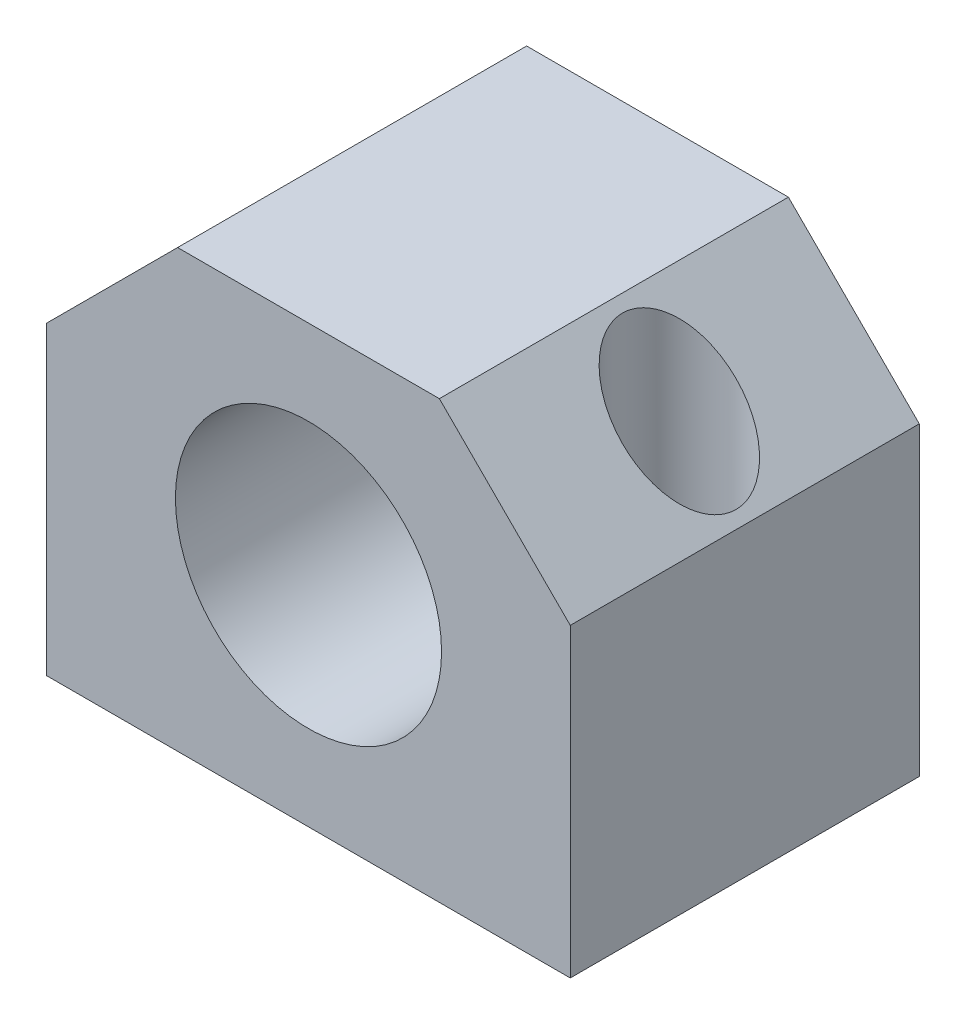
SolidWorks part; units mm, degrees
ref_plane "Plan de face" through (0, 0, 0) normal (0, 0, 1) x (1, 0, 0)
ref_plane "Plan de dessus" through (0, 0, 0) normal (0, 1, 0) x (1, 0, 0)
ref_plane "Plan de droite" through (0, 0, 0) normal (1, 0, 0) x (0, 0, -1)
sketch "Esquisse1" plane through (0, 0, 0) normal (0, 0, 1) x (1, 0, 0)
  line L0 (-35.9199, 0) -> (33.5688, 0) construction
  line L1 (0, 38.7935) -> (0, -32.5238) construction
  line L2 (-30, -25) -> (30, -25)
  line L3 (30, -25) -> (30, 10)
  line L4 (30, 10) -> (15, 25)
  line L5 (15, 25) -> (-15, 25)
  line L6 (-15, 25) -> (-30, 10)
  line L7 (-30, 10) -> (-30, -25)
  circle A0 centre (0, 0) radius 15.25
  dimension "D7" = 30.5
  dimension "D1" = 60
  dimension "D2" = 45
  dimension "D3" = 45
  dimension "D4" = 50
  dimension "D5" = 15
  dimension "D6" = 15
extrude "Extrusion1" add sketch "Esquisse1" along normal blind 40
hole_wizard "Perçage6" positions "Esquisse7" profile "Esquisse6" legacy
sketch "Esquisse7" plane through (0, 25, 0) normal (0, 1, 0) x (-1, 0, 0)
  line L0 (0, -7.7648) -> (0, 52.6919) construction
  line L2 (-22.5, -7.7648) -> (-22.5, 58.6217) construction
  line L6 (51.0225, 20) -> (-52.809, 20) construction
  line L8 (-15, 0) -> (15, 0) construction
  line L9 (15.25, 40) -> (-15.25, 40) construction
  line L10 (15, 40) -> (15, 0) construction
  line L11 (-15, 40) -> (-15, 0) construction
  point P0 (-22.5, 20)
  point P31 (22.5, 20)
  dimension "D1" = 22.5
sketch "Esquisse6" plane through (22.5, 25, 20) normal (1, 0, 0) x (0, 0, 1)
  line L0 (0, 0) -> (0, 51.9528)
  line L1 (0, 51.9528) -> (3.25, 50)
  line L2 (3.25, 50) -> (3.25, 30)
  line L3 (3.25, 30) -> (6.5, 30)
  line L4 (6.5, 0) -> (0, 0)
  line L5 (0, -11.3109) -> (0, 121.1557) construction
  line L6 (0, 51.9528) -> (-3.25, 50) construction
  line L7 (6.5, 30) -> (6.5, 0)
  dimension "Diamètre" = 6.5
  dimension "Profondeur" = 50
  dimension "Diamètre chambrage" = 13
  dimension "Profondeur chambrage" = 30
  dimension "Angle" = 118
